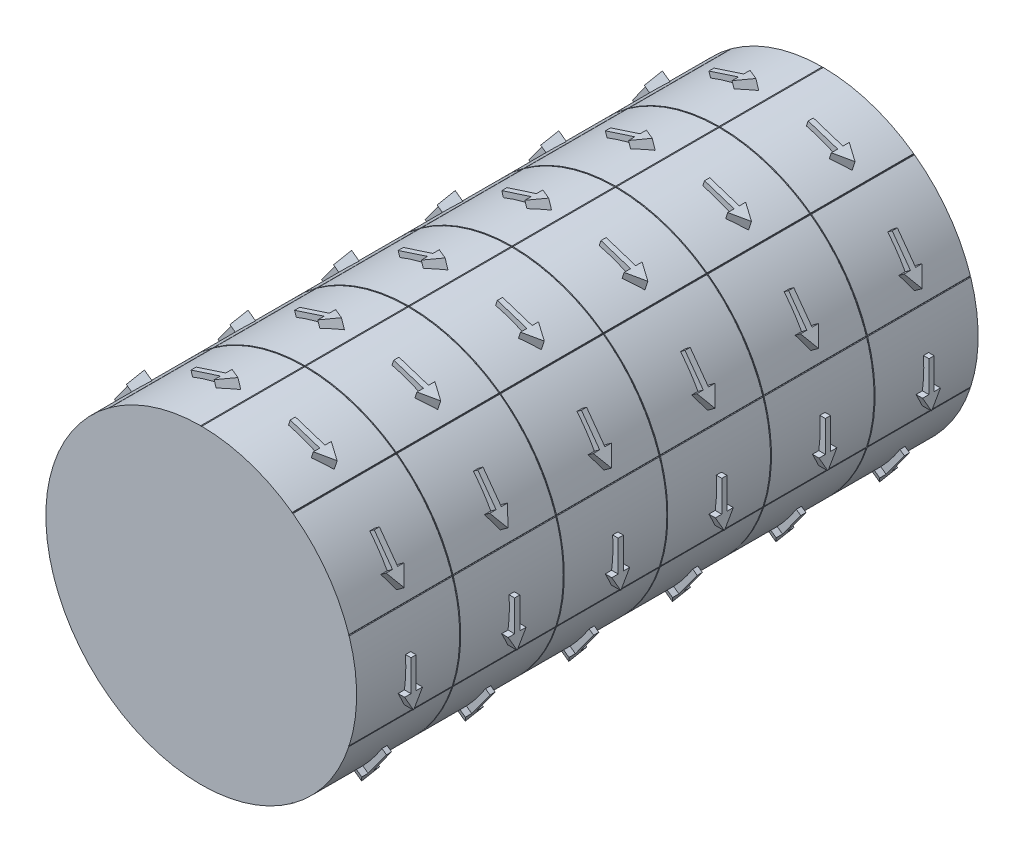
SolidWorks part; units mm, degrees
ref_plane "Face" through (0, 0, 0) normal (0, 0, 1) x (1, 0, 0)
ref_plane "Dessus" through (0, 0, 0) normal (0, 1, 0) x (1, 0, 0)
ref_plane "Droite" through (0, 0, 0) normal (1, 0, 0) x (0, 0, -1)
sketch "Esquisse2" plane through (0, 0, 0) normal (0, 0, 1) x (1, 0, 0)
  circle A0 centre (0, 0) radius 15
  dimension "D1" = 30
extrude "Boss.-Extru.1" add sketch "Esquisse2" along normal blind 60
sketch "Esquisse3" plane through (0, 0, 60) normal (0, 0, 1) x (1, 0, 0)
  line L0 (0, 0) -> (0, 16.1922) construction
  line L1 (-0.05, 15) -> (0.05, 15)
  line L2 (0.05, 15) -> (0, 14.95)
  line L3 (0, 14.95) -> (-0.05, 15)
  circle A0 centre (0, 0) radius 15 construction
  dimension "D1" = 0.1
extrude "Enlèv. mat.-Extru.1" cut sketch "Esquisse3" against normal through all
pattern_circular "Répétition circulaire1" count 10 over 360 about axis through (0, 0, 0) along (0, 0, 1) of "Enlèv. mat.-Extru.1"
sketch "Esquisse4" plane through (0, 0, 0) normal (0, 1, 0) x (1, 0, 0)
  line L0 (-18.9456, -10) -> (-14.5667, -10) construction
  line L1 (-15, -9.95) -> (-14.9, -9.95)
  line L2 (-15, -9.95) -> (-15, -10.05)
  line L3 (-15, -10.05) -> (-14.9, -10.05)
  line L4 (-14.9, -9.95) -> (-14.9, -10.05)
  line L5 (-15, 0) -> (-15, -60) construction
  line L6 (0, 0) -> (0, 3.6607) construction
  dimension "D1" = 0.1
  dimension "D2" = 0.1
  dimension "D3" = 10
revolve "Enlèvement de matière-Révolution1" cut sketch "Esquisse4" angle 360 about L6
pattern_linear "Répétition linéaire1" count 5 spacing 10 along (0, 0, 1) of "Enlèvement de matière-Révolution1"
ref_plane "Plan1" through (15, 0, 0) normal (1, 0, 0) x (0, 0, -1)
sketch "Esquisse5" plane through (15, 0, 0) normal (1, 0, 0) x (0, 0, -1)
  line L0 (-55.25, 1) -> (-54.75, 1)
  line L1 (-54.75, 1) -> (-54.75, -2)
  line L2 (-54.75, -2) -> (-54.134, -2)
  line L3 (-54.134, -2) -> (-55, -3.5)
  line L4 (-55, -3.5) -> (-55.866, -2)
  line L5 (-55.866, -2) -> (-55.25, -2)
  line L6 (-55.25, -2) -> (-55.25, 1)
  line L7 (-55, -3.5) -> (-55, 2.5361) construction
  line L8 (-60, 4.5878) -> (-60, -4.5878) construction
  line L9 (16.5, 0) -> (-16.5, 0) construction
  dimension "D1" = 0.5
  dimension "D2" = 5
  dimension "D3" = 1
  dimension "D4" = 30
  dimension "D5" = 30
  dimension "D6" = 3
  dimension "D7" = 4.5
extrude "Boss.-Extru.2" add sketch "Esquisse5" along normal blind 0.5 and the other way blind 1
pattern_linear "Répétition linéaire2" count 6 spacing 10 along (0, 0, -1) of "Boss.-Extru.2"
pattern_circular "Répétition circulaire2" count 10 over 360 about axis through (0, 0, 0) along (0, 0, 1) of "Répétition linéaire2", "Boss.-Extru.2"
